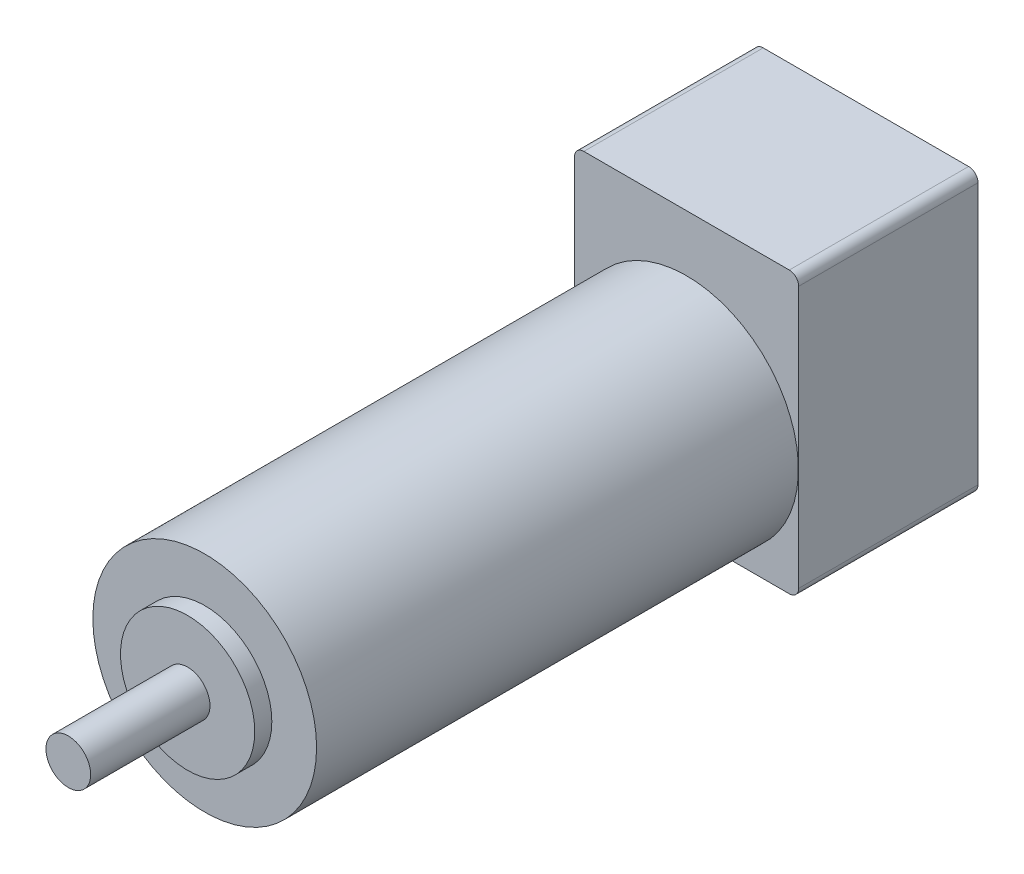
SolidWorks part; units mm, degrees
ref_plane "Front Plane" through (0, 0, 0) normal (0, 0, 1) x (1, 0, 0)
ref_plane "Top Plane" through (0, 0, 0) normal (0, 1, 0) x (1, 0, 0)
ref_plane "Right Plane" through (0, 0, 0) normal (1, 0, 0) x (0, 0, -1)
sketch "Sketch1" plane through (0, 0, 0) normal (0, 0, 1) x (1, 0, 0)
  circle A0 centre (0, 0) radius 30.2514
  dimension "D1" = 60.5028
extrude "Extrude1" add sketch "Sketch1" along normal blind 130.2766
sketch "Sketch2" plane through (0, 0, 0) normal (0, 0, -1) x (-1, 0, 0)
  line L1 (30.3022, -30.353) -> (-30.3276, -30.353)
  line L2 (30.3022, -30.353) -> (30.3022, 45.466)
  line L3 (30.3022, 45.466) -> (-30.3276, 45.466)
  line L4 (-30.3276, -30.353) -> (-30.3276, 45.466)
  dimension "D1" = 60.6298
  dimension "D2" = 75.819
  dimension "D3" = 30.353
  dimension "D4" = 30.3022
extrude "Extrude2" add sketch "Sketch2" along normal blind 48.4886
sketch "Sketch3" plane through (0, 0, 130.2766) normal (0, 0, 1) x (1, 0, 0)
  circle A0 centre (0, 0) radius 18.1483
  dimension "D1" = 36.2966
extrude "Extrude3" add sketch "Sketch3" along normal blind 4.6228
sketch "Sketch4" plane through (0, 0, 134.8994) normal (0, 0, 1) x (1, 0, 0)
  circle A0 centre (0, 0) radius 6.0452
  dimension "D1" = 12.0904
extrude "Extrude4" add sketch "Sketch4" along normal blind 32.258
fillet "Fillet1" radius 2.54 1 edges at (30.3276, -30.353, -24.2443)
fillet "Fillet2" radius 2.54 1 edges at (30.3276, 45.466, -24.2443)
fillet "Fillet3" radius 2.54 1 edges at (-30.3022, 45.466, -24.2443)
fillet "Fillet4" radius 2.54 1 edges at (-30.3022, -30.353, -24.2443)
